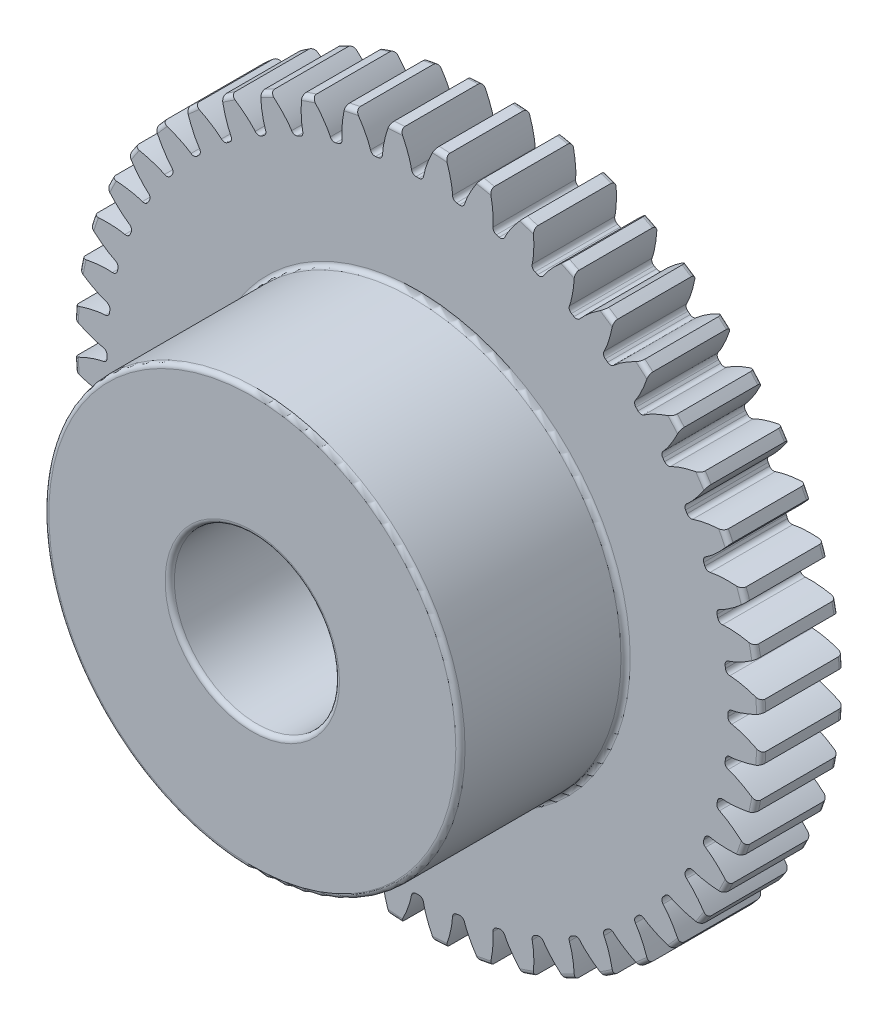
SolidWorks part; units mm, degrees
ref_plane "Front Plane" through (0, 0, 0) normal (0, 0, 1) x (1, 0, 0)
ref_plane "Top Plane" through (0, 0, 0) normal (0, 1, 0) x (1, 0, 0)
ref_plane "Right Plane" through (0, 0, 0) normal (1, 0, 0) x (0, 0, -1)
sketch "Sketch1" plane through (0, 0, 0) normal (0, 0, 1) x (1, 0, 0)
  line L0 (0, 0) -> (0, 12.7) construction
  line L1 (-4.0817, 14.1856) -> (4.0817, 11.2144) construction
  circle A0 centre (0, 0) radius 12.0385 construction
  circle A1 centre (0, 0) radius 13.2292 construction
  circle A2 centre (0, 0) radius 12.7 construction
  circle A3 centre (0, 0) radius 11.9341 construction
  circle A4 centre (0, 0) radius 3.175 construction
  circle A5 centre (0, 0) radius 8.001 construction
  point P8 (609.6, 0)
  point P13 (609.6, 0)
sketch "Sketch2" plane through (0, 0, 0) normal (1, 0, 0) x (0, 0, -1)
  line L0 (-4.7625, 0) -> (4.7625, 0) construction
  line L1 (-4.7625, 13.2292) -> (4.7625, 13.2292) construction
  point P2 (0, 13.2292)
  point P4 (1.5875, 0)
  point P6 (1.5875, 13.2292)
  dimension "Overall Width" = 9.525
  dimension "Hub Width" = 6.35
  dimension "Face Width" = 3.175
sketch "Sketch3" plane through (0, 0, 0) normal (0, 0, 1) x (1, 0, 0)
  circle A0 centre (0, 0) radius 13.2292
  circle A1 centre (0, 0) radius 13.2292 construction
extrude "Boss-Extrude1" add sketch "Sketch3" against normal up to vertex and the other way up to vertex
sketch "Sketch5" plane through (0, 0, 0) normal (1, 0, 0) x (0, 0, -1)
  line L1 (-4.7625, 13.2292) -> (1.5875, 13.2292)
  line L2 (-4.7625, 13.2292) -> (-4.7625, 8.001)
  line L3 (-4.7625, 8.001) -> (1.5875, 8.001)
  line L4 (1.5875, 13.2292) -> (1.5875, 8.001)
  line L11 (4.7625, 3.175) -> (-4.7625, 3.175)
  line L12 (4.7625, 3.175) -> (4.7625, 0)
  line L13 (4.7625, 0) -> (-4.7625, 0)
  line L14 (-4.7625, 3.175) -> (-4.7625, 0)
  point P5 (0, 3.175)
  point P12 (0, 8.001)
revolve "Cut-Revolve1" cut sketch "Sketch5" angle 360 about L0
fillet "Fillet2" radius 0.1775 6 edges at (13.2292, 0, -4.7625) (3.175, 0, -4.7625) (3.175, 0, 4.7625) (8.001, 0, -1.5875) (13.2292, 0, -1.5875) (8.001, 0, 4.7625)
sketch "Sketch4" plane through (0, 0, 0) normal (0, 0, 1) x (1, 0, 0)
  line L0 (0, 0) -> (11.9321, 0.2127) construction
  line L2 (0, 0) -> (11.9321, -0.2127) construction
  line L4 (11.9321, 0.2127) -> (11.9322, 0.2127)
  line L5 (11.9322, -0.2127) -> (11.9321, -0.2127)
  arc A0 (11.9321, 0.2127) -> (11.9321, -0.2127) centre (0, 0) cw
  arc A3 (13.2126, 0.6611) -> (13.2126, -0.6611) centre (0, 0) cw
  circle A4 centre (0, 0) radius 13.2292 construction
  spline S0 degree 4 poles (11.9322, 0.2127) (11.9342, 0.2127) (11.9399, 0.2129) (11.9506, 0.2136) (11.968, 0.2151) (11.9902, 0.2174) (12.0189, 0.2211) (12.0527, 0.2262) (12.0898, 0.2325) (12.1301, 0.2404) (12.1703, 0.2489) (12.2103, 0.2582) (12.2502, 0.2681) (12.2985, 0.2808) (12.3563, 0.2972) (12.4237, 0.3179) (12.5002, 0.3431) (12.5779, 0.3708) (12.6543, 0.3997) (12.7314, 0.4308) (12.8058, 0.4621) (12.883, 0.4966) (12.9542, 0.5294) (13.0337, 0.5682) (13.0979, 0.6002) (13.1824, 0.6446) (13.2322, 0.6715) (13.2904, 0.7038) (13.3162, 0.7185) (13.3321, 0.7276) knots 0 0 0 0 0 0.005377 0.015084 0.028532 0.04661 0.064855 0.092111 0.119476 0.146842 0.174209 0.201575 0.228941 0.256307 0.307035 0.361767 0.4165 0.471232 0.525964 0.580697 0.635429 0.690161 0.744894 0.799626 0.854358 0.909091 0.954545 1 1 1 1 1 construction
  spline S1 degree 4 poles (11.9322, 0.2127) (11.9342, 0.2127) (11.9399, 0.2129) (11.9506, 0.2136) (11.968, 0.2151) (11.9902, 0.2174) (12.0189, 0.2211) (12.0527, 0.2262) (12.0898, 0.2325) (12.1301, 0.2404) (12.1703, 0.2489) (12.2103, 0.2582) (12.2502, 0.2681) (12.2985, 0.2808) (12.3563, 0.2972) (12.4237, 0.3179) (12.5002, 0.3431) (12.5779, 0.3708) (12.6543, 0.3997) (12.7314, 0.4308) (12.8058, 0.4621) (12.883, 0.4966) (12.9542, 0.5294) (13.0337, 0.5682) (13.0979, 0.6002) (13.164, 0.635) (13.1962, 0.6522) (13.2126, 0.6611) knots 0 0 0 0 0 0.005377 0.015084 0.028532 0.04661 0.064855 0.092111 0.119476 0.146842 0.174209 0.201575 0.228941 0.256307 0.307035 0.361767 0.4165 0.471232 0.525964 0.580697 0.635429 0.690161 0.744894 0.799626 0.854358 0.909091 0.909091 0.909091 0.909091 0.909091
  spline S2 degree 4 poles (11.9322, -0.2127) (11.9342, -0.2127) (11.9399, -0.2129) (11.9506, -0.2136) (11.968, -0.2151) (11.9902, -0.2174) (12.0189, -0.2211) (12.0527, -0.2262) (12.0898, -0.2325) (12.1301, -0.2404) (12.1703, -0.2489) (12.2103, -0.2582) (12.2502, -0.2681) (12.2985, -0.2808) (12.3563, -0.2972) (12.4237, -0.3179) (12.5002, -0.3431) (12.5779, -0.3708) (12.6543, -0.3997) (12.7314, -0.4308) (12.8058, -0.4621) (12.883, -0.4966) (12.9542, -0.5294) (13.0337, -0.5682) (13.0979, -0.6002) (13.1824, -0.6446) (13.2322, -0.6715) (13.2904, -0.7038) (13.3162, -0.7185) (13.3321, -0.7276) knots 0 0 0 0 0 0.005377 0.015084 0.028532 0.04661 0.064855 0.092111 0.119476 0.146842 0.174209 0.201575 0.228941 0.256307 0.307035 0.361767 0.4165 0.471232 0.525964 0.580697 0.635429 0.690161 0.744894 0.799626 0.854358 0.909091 0.954545 1 1 1 1 1 construction
  spline S3 degree 4 poles (11.9322, -0.2127) (11.9342, -0.2127) (11.9399, -0.2129) (11.9506, -0.2136) (11.968, -0.2151) (11.9902, -0.2174) (12.0189, -0.2211) (12.0527, -0.2262) (12.0898, -0.2325) (12.1301, -0.2404) (12.1703, -0.2489) (12.2103, -0.2582) (12.2502, -0.2681) (12.2985, -0.2808) (12.3563, -0.2972) (12.4237, -0.3179) (12.5002, -0.3431) (12.5779, -0.3708) (12.6543, -0.3997) (12.7314, -0.4308) (12.8058, -0.4621) (12.883, -0.4966) (12.9542, -0.5294) (13.0337, -0.5682) (13.0979, -0.6002) (13.164, -0.635) (13.1962, -0.6522) (13.2126, -0.6611) knots 0 0 0 0 0 0.005377 0.015084 0.028532 0.04661 0.064855 0.092111 0.119476 0.146842 0.174209 0.201575 0.228941 0.256307 0.307035 0.361767 0.4165 0.471232 0.525964 0.580697 0.635429 0.690161 0.744894 0.799626 0.854358 0.909091 0.909091 0.909091 0.909091 0.909091
extrude "Cut-Extrude1" cut sketch "Sketch4" against normal through all both and the other way through all
fillet "Fillet1" radius 0.1775 2 edges at (11.9321, -0.2127, -3.175) (11.9321, 0.2127, -3.175)
pattern_circular "CirPattern1" count 48 over 360 about axis through (0, 0, 4.7625) along (0, 0, -1) of "Cut-Extrude1", "Fillet1"
equation "\"Root Diameter@Sketch1\"=\"Root Diameter\""
equation "\"OD | Outside Diameter@Sketch1\"=\"Outside Diameter\""
equation "\"D1@CirPattern1\"=\"Number of Teeth\""
equation "\"Diametral Pitch\"= 48"
equation "\"Number of Teeth\"= 48"
equation "\"Pressure Angle\"=20"
equation "\"Pitch Diameter\"= \"Number of Teeth\" / \"Diametral Pitch\""
equation "\"Base Diameter\"= \"Pitch Diameter\" * cos ( \"Pressure Angle\" )"
equation "\"Outside Diameter\"= ( \"Number of Teeth\" + 2 ) / \"Diametral Pitch\""
equation "\"Dedendum\"= 1.25 / \"Diametral Pitch\""
equation "\"Root Diameter\"= \"Pitch Diameter\" - ( 2 * \"Dedendum\" )"
equation "\"Pitch Angle\"= 360deg / \"Number of Teeth\""
equation "\"Alpha\"= sqr ( \"Pitch Diameter\" ^ 2 - \"Base Diameter\" ^ 2 ) / \"Base Diameter\" * 180 / PI - \"Pressure Angle\""
equation "\"Beta\"= ( \"Pitch Angle\" / 4 - \"Alpha\" )"
equation "\"Phi\"= sqr ( ( \"Outside Diameter\" / 2 ) ^ 2 - ( \"Base Diameter\" / 2 ) ^ 2 ) / ( \"Base Diameter\" / 2 )"
equation "\"Addendum\"= 1 / \"Diametral Pitch\""
equation "\"WorkingDepth\"= 2 / \"Diametral Pitch\""
equation "\"WholeDepth\"= 2.25 / \"Diametral Pitch\""
equation "\"Clearance\"= 0.25 / \"Diametral Pitch\""
equation "\"ToothThickness\"= ( pi * 2 ) / \"Diametral Pitch\""
equation "\"CircularPitch\"= pi / \"Diametral Pitch\""
equation "\"Number of Teeth@Sketch1\"=\"Number of Teeth\""
equation "\"Gear Pitch | Diametral Pitch@Sketch1\"=\"Diametral Pitch\""
equation "\"Pressure Angle@Sketch1\"=\"Pressure Angle\""
equation "\"Gear Pitch Diameter@Sketch1\"=\"Pitch Diameter\""
equation "\"Base Diameter@Sketch1\"=\"Base Diameter\""
equation "\"Fillet\"= \"Clearance\" * cos ( \"Pressure Angle\" ) * tan ( ( 90 + \"Pressure Angle\" ) / 2 )"
equation "\"D1@Fillet1\"=\"Fillet\""
equation "\"D1@Sketch4\"=if( \"Base Diameter\">\"Root Diameter\",\"Root Diameter\",\"Base Diameter\"-.00001)"
equation "\"D1@Fillet2\"=\"Fillet\""
